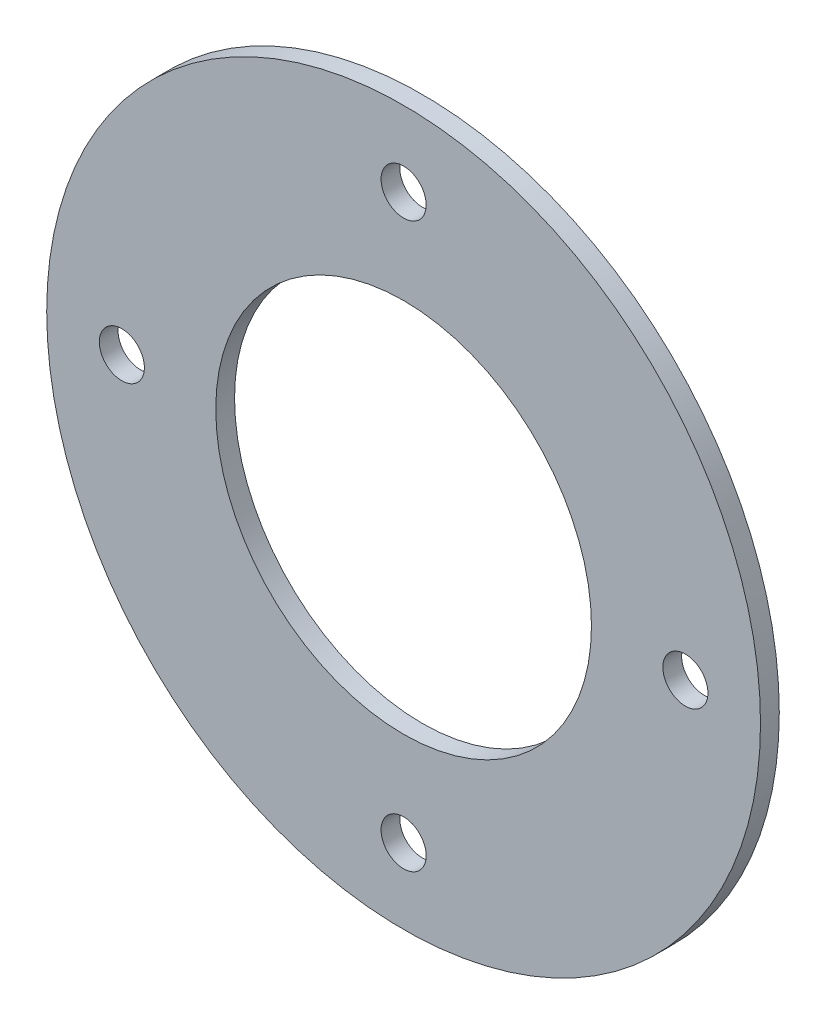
SolidWorks part; units mm, degrees
ref_plane "Face" through (0, 0, 0) normal (0, 0, 1) x (1, 0, 0)
ref_plane "Dessus" through (0, 0, 0) normal (0, 1, 0) x (1, 0, 0)
ref_plane "Droite" through (0, 0, 0) normal (1, 0, 0) x (0, 0, -1)
sketch "Esquisse1" plane through (0, 0, 0) normal (0, 0, 1) x (1, 0, 0)
  circle A0 centre (0, 0) radius 95
  circle A1 centre (0, 0) radius 50
  dimension "D1" = 190
  dimension "D2" = 100
extrude "Extrusion1" add sketch "Esquisse1" along normal blind 5
sketch "Esquisse2" plane through (0, 0, 0) normal (0, 0, -1) x (-1, 0, 0)
  line L0 (0, 0) -> (0, -271.7158) construction
  circle A0 centre (0, -75) radius 6
  dimension "D1" = 12
  dimension "D2" = 75
extrude "Enlèv. mat.-Extru.1" cut sketch "Esquisse2" against normal through all
pattern_circular "Répétition circulaire1" count 4 over 360 about axis through (0, 0, 0) along (0, 0, 1) of "Enlèv. mat.-Extru.1"
